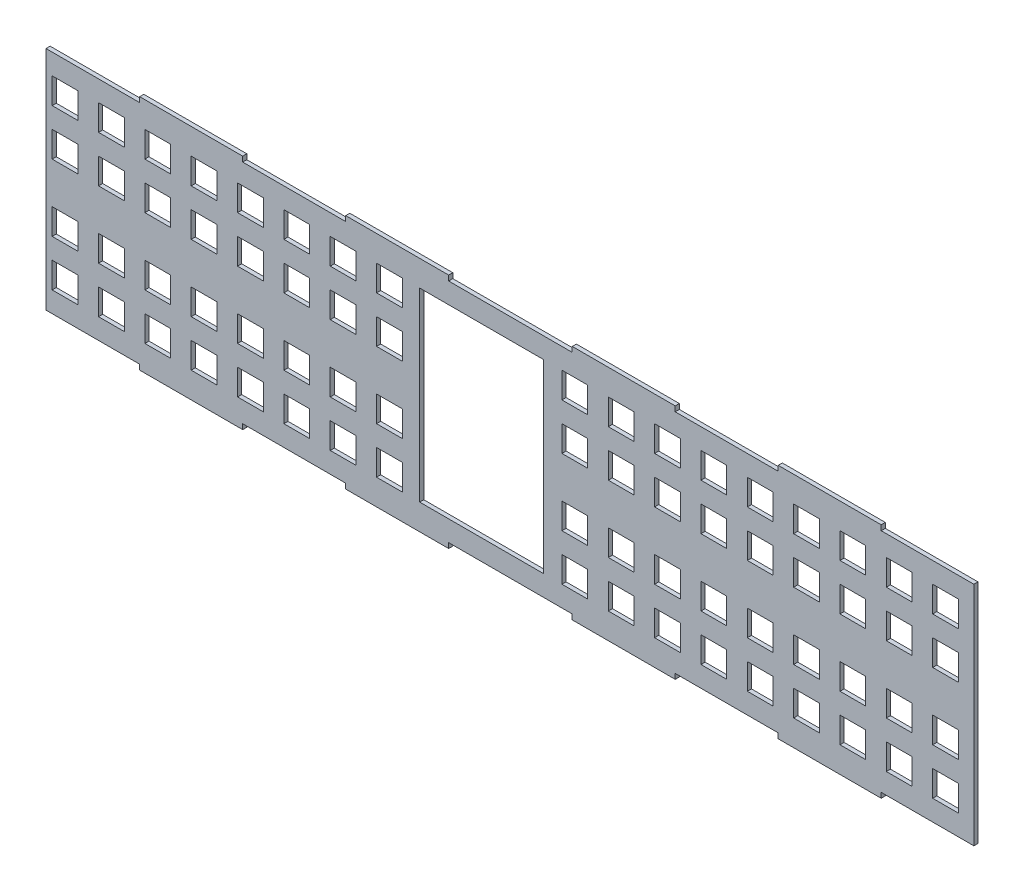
SolidWorks part; units mm, degrees
ref_plane "Front Plane" through (0, 0, 0) normal (0, 0, 1) x (1, 0, 0)
ref_plane "Top Plane" through (0, 0, 0) normal (0, 1, 0) x (1, 0, 0)
ref_plane "Right Plane" through (0, 0, 0) normal (1, 0, 0) x (0, 0, -1)
sketch "Croquis1" plane through (0, 0, 0) normal (0, 0, 1) x (1, 0, 0)
  line L0 (0, 0) -> (385.6404, 0) construction
  line L1 (-240, -55) -> (-180, -55)
  line L2 (-240, -55) -> (-240, 55)
  line L3 (-240, 55) -> (-180, 55)
  line L4 (240, -55) -> (240, 55)
  line L5 (-240, -55) -> (240, 55) construction
  line L6 (-240, 55) -> (240, -55) construction
  line L8 (-180, -55) -> (-180, -57.5)
  line L9 (-180, -57.5) -> (-130, -57.5)
  line L10 (-130, -55) -> (-130, -57.5)
  line L12 (-80, -55) -> (-80, -57.5)
  line L13 (-80, -57.5) -> (-30, -57.5)
  line L14 (-30, -55) -> (-30, -57.5)
  line L16 (30, -55) -> (30, -57.5)
  line L17 (30, -57.5) -> (80, -57.5)
  line L18 (80, -55) -> (80, -57.5)
  line L20 (130, -55) -> (130, -57.5)
  line L21 (130, -57.5) -> (180, -57.5)
  line L22 (180, -55) -> (180, -57.5)
  line L23 (180, 55) -> (180, 57.5)
  line L24 (130, 57.5) -> (180, 57.5)
  line L25 (130, 55) -> (130, 57.5)
  line L27 (80, 55) -> (80, 57.5)
  line L28 (30, 57.5) -> (80, 57.5)
  line L29 (30, 55) -> (30, 57.5)
  line L31 (-30, 55) -> (-30, 57.5)
  line L32 (-80, 57.5) -> (-30, 57.5)
  line L33 (-80, 55) -> (-80, 57.5)
  line L35 (-130, 55) -> (-130, 57.5)
  line L36 (-180, 57.5) -> (-130, 57.5)
  line L37 (-180, 55) -> (-180, 57.5)
  line L39 (-130, 55) -> (-80, 55)
  line L40 (-30, 55) -> (30, 55)
  line L41 (80, 55) -> (130, 55)
  line L42 (180, 55) -> (240, 55)
  line L43 (-130, -55) -> (-80, -55)
  line L44 (-30, -55) -> (30, -55)
  line L45 (80, -55) -> (130, -55)
  line L46 (180, -55) -> (240, -55)
  point P0 (0, 0)
  dimension "D1" = 480
  dimension "D2" = 110
  dimension "D3" = 60
  dimension "D4" = 50
  dimension "D5" = 50
  dimension "D6" = 50
  dimension "D7" = 50
  dimension "D8" = 60
  dimension "D9" = 50
  dimension "D10" = 50
  dimension "D11" = 60
  dimension "D12" = 2.5
  dimension "D13" = 2.5
  dimension "D14" = 2.5
extrude "Saliente-Extruir1" add sketch "Croquis1" along normal blind 2
sketch "Croquis2" plane through (0, 0, 2) normal (0, 0, 1) x (1, 0, 0)
  line L0 (-240, 0) -> (240, 0) construction
  line L1 (-240, 55) -> (-240, -55) construction
  line L2 (240, -55) -> (240, 55) construction
  line L29 (70, 45) -> (82.5, 32.5) construction
  line L34 (-210, 22.5) -> (-222.5, 10) construction
  line L35 (-210, 10) -> (-222.5, 22.5) construction
  line L36 (-210, 32.5) -> (-222.5, 45) construction
  line L37 (-210, 45) -> (-222.5, 32.5) construction
  line L46 (-222.5, 10) -> (-222.5, 22.5)
  line L47 (-210, 22.5) -> (-222.5, 22.5)
  line L48 (-210, 10) -> (-210, 22.5)
  line L49 (-210, 10) -> (-222.5, 10)
  line L50 (-222.5, 45) -> (-222.5, 32.5)
  line L51 (-210, 32.5) -> (-222.5, 32.5)
  line L52 (-210, 45) -> (-210, 32.5)
  line L53 (-210, 45) -> (-222.5, 45)
  line L54 (70, 32.5) -> (82.5, 45) construction
  line L55 (-200, 45) -> (-187.5, 32.5) construction
  line L56 (-200, 32.5) -> (-187.5, 45) construction
  line L57 (-200, 10) -> (-187.5, 22.5) construction
  line L58 (-200, 22.5) -> (-187.5, 10) construction
  line L59 (-165, 22.5) -> (-177.5, 10) construction
  line L60 (-165, 10) -> (-177.5, 22.5) construction
  line L61 (-165, 32.5) -> (-177.5, 45) construction
  line L62 (-165, 45) -> (-177.5, 32.5) construction
  line L63 (-155, 45) -> (-142.5, 32.5) construction
  line L64 (-155, 32.5) -> (-142.5, 45) construction
  line L65 (-155, 10) -> (-142.5, 22.5) construction
  line L66 (-155, 22.5) -> (-142.5, 10) construction
  line L67 (-120, 22.5) -> (-132.5, 10) construction
  line L68 (-120, 10) -> (-132.5, 22.5) construction
  line L69 (-120, 32.5) -> (-132.5, 45) construction
  line L70 (-120, 45) -> (-132.5, 32.5) construction
  line L71 (-200, 45) -> (-187.5, 45)
  line L72 (-200, 45) -> (-200, 32.5)
  line L73 (-200, 32.5) -> (-187.5, 32.5)
  line L74 (-187.5, 45) -> (-187.5, 32.5)
  line L75 (-200, 10) -> (-187.5, 10)
  line L76 (-200, 10) -> (-200, 22.5)
  line L77 (-200, 22.5) -> (-187.5, 22.5)
  line L78 (-187.5, 10) -> (-187.5, 22.5)
  line L79 (-177.5, 10) -> (-177.5, 22.5)
  line L80 (-165, 22.5) -> (-177.5, 22.5)
  line L81 (-165, 10) -> (-165, 22.5)
  line L82 (-165, 10) -> (-177.5, 10)
  line L83 (-177.5, 45) -> (-177.5, 32.5)
  line L84 (-165, 32.5) -> (-177.5, 32.5)
  line L85 (-165, 45) -> (-165, 32.5)
  line L86 (-165, 45) -> (-177.5, 45)
  line L87 (-155, 45) -> (-142.5, 45)
  line L88 (-155, 45) -> (-155, 32.5)
  line L89 (-155, 32.5) -> (-142.5, 32.5)
  line L90 (-142.5, 45) -> (-142.5, 32.5)
  line L91 (-155, 10) -> (-142.5, 10)
  line L92 (-155, 10) -> (-155, 22.5)
  line L93 (-155, 22.5) -> (-142.5, 22.5)
  line L94 (-142.5, 10) -> (-142.5, 22.5)
  line L95 (-132.5, 10) -> (-132.5, 22.5)
  line L96 (-120, 22.5) -> (-132.5, 22.5)
  line L97 (-120, 10) -> (-120, 22.5)
  line L98 (-120, 10) -> (-132.5, 10)
  line L99 (-132.5, 45) -> (-132.5, 32.5)
  line L100 (-120, 32.5) -> (-132.5, 32.5)
  line L101 (-120, 45) -> (-120, 32.5)
  line L102 (-120, 45) -> (-132.5, 45)
  line L103 (70, 10) -> (82.5, 22.5) construction
  line L104 (-110, 45) -> (-97.5, 32.5) construction
  line L105 (-110, 32.5) -> (-97.5, 45) construction
  line L106 (-110, 10) -> (-97.5, 22.5) construction
  line L107 (-110, 22.5) -> (-97.5, 10) construction
  line L108 (-75, 22.5) -> (-87.5, 10) construction
  line L109 (-75, 10) -> (-87.5, 22.5) construction
  line L110 (-75, 32.5) -> (-87.5, 45) construction
  line L111 (-75, 45) -> (-87.5, 32.5) construction
  line L112 (-65, 45) -> (-52.5, 32.5) construction
  line L113 (-65, 32.5) -> (-52.5, 45) construction
  line L114 (-65, 10) -> (-52.5, 22.5) construction
  line L115 (-65, 22.5) -> (-52.5, 10) construction
  line L116 (-30, 22.5) -> (-42.5, 10) construction
  line L117 (-30, 10) -> (-42.5, 22.5) construction
  line L118 (-30, 32.5) -> (-42.5, 45) construction
  line L119 (-30, 45) -> (-42.5, 32.5) construction
  line L120 (-20, 45) -> (-7.5, 32.5) construction
  line L121 (-20, 32.5) -> (-7.5, 45) construction
  line L122 (-20, 10) -> (-7.5, 22.5) construction
  line L123 (-20, 22.5) -> (-7.5, 10) construction
  line L124 (15, 22.5) -> (2.5, 10) construction
  line L125 (15, 10) -> (2.5, 22.5) construction
  line L126 (15, 32.5) -> (2.5, 45) construction
  line L127 (15, 45) -> (2.5, 32.5) construction
  line L128 (25, 45) -> (37.5, 32.5) construction
  line L129 (25, 32.5) -> (37.5, 45) construction
  line L130 (25, 10) -> (37.5, 22.5) construction
  line L131 (25, 22.5) -> (37.5, 10) construction
  line L132 (60, 22.5) -> (47.5, 10) construction
  line L133 (60, 10) -> (47.5, 22.5) construction
  line L134 (60, 32.5) -> (47.5, 45) construction
  line L135 (60, 45) -> (47.5, 32.5) construction
  line L136 (-110, 45) -> (-97.5, 45)
  line L137 (-110, 45) -> (-110, 32.5)
  line L138 (-110, 32.5) -> (-97.5, 32.5)
  line L139 (-97.5, 45) -> (-97.5, 32.5)
  line L140 (-110, 10) -> (-97.5, 10)
  line L141 (-110, 10) -> (-110, 22.5)
  line L142 (-110, 22.5) -> (-97.5, 22.5)
  line L143 (-97.5, 10) -> (-97.5, 22.5)
  line L144 (-87.5, 10) -> (-87.5, 22.5)
  line L145 (-75, 22.5) -> (-87.5, 22.5)
  line L146 (-75, 10) -> (-75, 22.5)
  line L147 (-75, 10) -> (-87.5, 10)
  line L148 (-87.5, 45) -> (-87.5, 32.5)
  line L149 (-75, 32.5) -> (-87.5, 32.5)
  line L150 (-75, 45) -> (-75, 32.5)
  line L151 (-75, 45) -> (-87.5, 45)
  line L152 (-65, 45) -> (-52.5, 45)
  line L153 (-65, 45) -> (-65, 32.5)
  line L154 (-65, 32.5) -> (-52.5, 32.5)
  line L155 (-52.5, 45) -> (-52.5, 32.5)
  line L156 (-65, 10) -> (-52.5, 10)
  line L157 (-65, 10) -> (-65, 22.5)
  line L158 (-65, 22.5) -> (-52.5, 22.5)
  line L159 (-52.5, 10) -> (-52.5, 22.5)
  line L160 (-42.5, 10) -> (-42.5, 22.5)
  line L161 (-30, 22.5) -> (-42.5, 22.5)
  line L162 (-30, 10) -> (-30, 22.5)
  line L163 (-30, 10) -> (-42.5, 10)
  line L164 (-42.5, 45) -> (-42.5, 32.5)
  line L165 (-30, 32.5) -> (-42.5, 32.5)
  line L166 (-30, 45) -> (-30, 32.5)
  line L167 (-30, 45) -> (-42.5, 45)
  line L168 (-20, 45) -> (-7.5, 45)
  line L169 (-20, 45) -> (-20, 32.5)
  line L170 (-20, 32.5) -> (-7.5, 32.5)
  line L171 (-7.5, 45) -> (-7.5, 32.5)
  line L172 (-20, 10) -> (-7.5, 10)
  line L173 (-20, 10) -> (-20, 22.5)
  line L174 (-20, 22.5) -> (-7.5, 22.5)
  line L175 (-7.5, 10) -> (-7.5, 22.5)
  line L176 (2.5, 10) -> (2.5, 22.5)
  line L177 (15, 22.5) -> (2.5, 22.5)
  line L178 (15, 10) -> (15, 22.5)
  line L179 (15, 10) -> (2.5, 10)
  line L180 (2.5, 45) -> (2.5, 32.5)
  line L181 (15, 32.5) -> (2.5, 32.5)
  line L182 (15, 45) -> (15, 32.5)
  line L183 (15, 45) -> (2.5, 45)
  line L184 (25, 45) -> (37.5, 45)
  line L185 (25, 45) -> (25, 32.5)
  line L186 (25, 32.5) -> (37.5, 32.5)
  line L187 (37.5, 45) -> (37.5, 32.5)
  line L188 (25, 10) -> (37.5, 10)
  line L189 (25, 10) -> (25, 22.5)
  line L190 (25, 22.5) -> (37.5, 22.5)
  line L191 (37.5, 10) -> (37.5, 22.5)
  line L192 (47.5, 10) -> (47.5, 22.5)
  line L193 (60, 22.5) -> (47.5, 22.5)
  line L194 (60, 10) -> (60, 22.5)
  line L195 (60, 10) -> (47.5, 10)
  line L196 (47.5, 45) -> (47.5, 32.5)
  line L197 (60, 32.5) -> (47.5, 32.5)
  line L198 (60, 45) -> (60, 32.5)
  line L199 (60, 45) -> (47.5, 45)
  line L200 (70, 22.5) -> (82.5, 10) construction
  line L201 (105, 22.5) -> (92.5, 10) construction
  line L202 (105, 10) -> (92.5, 22.5) construction
  line L203 (105, 32.5) -> (92.5, 45) construction
  line L204 (105, 45) -> (92.5, 32.5) construction
  line L205 (115, 45) -> (127.5, 32.5) construction
  line L206 (115, 32.5) -> (127.5, 45) construction
  line L207 (115, 10) -> (127.5, 22.5) construction
  line L208 (115, 22.5) -> (127.5, 10) construction
  line L209 (150, 22.5) -> (137.5, 10) construction
  line L210 (150, 10) -> (137.5, 22.5) construction
  line L211 (150, 32.5) -> (137.5, 45) construction
  line L212 (150, 45) -> (137.5, 32.5) construction
  line L213 (160, 45) -> (172.5, 32.5) construction
  line L214 (160, 32.5) -> (172.5, 45) construction
  line L215 (160, 10) -> (172.5, 22.5) construction
  line L216 (160, 22.5) -> (172.5, 10) construction
  line L217 (195, 22.5) -> (182.5, 10) construction
  line L218 (195, 10) -> (182.5, 22.5) construction
  line L219 (195, 32.5) -> (182.5, 45) construction
  line L220 (195, 45) -> (182.5, 32.5) construction
  line L221 (205, 45) -> (217.5, 32.5) construction
  line L222 (205, 32.5) -> (217.5, 45) construction
  line L223 (205, 10) -> (217.5, 22.5) construction
  line L224 (205, 22.5) -> (217.5, 10) construction
  line L248 (205, -22.5) -> (217.5, -10) construction
  line L249 (205, -10) -> (217.5, -22.5) construction
  line L250 (205, -32.5) -> (217.5, -45) construction
  line L251 (205, -45) -> (217.5, -32.5) construction
  line L252 (195, -45) -> (182.5, -32.5) construction
  line L253 (195, -32.5) -> (182.5, -45) construction
  line L254 (195, -10) -> (182.5, -22.5) construction
  line L255 (195, -22.5) -> (182.5, -10) construction
  line L256 (160, -22.5) -> (172.5, -10) construction
  line L257 (160, -10) -> (172.5, -22.5) construction
  line L258 (160, -32.5) -> (172.5, -45) construction
  line L259 (160, -45) -> (172.5, -32.5) construction
  line L260 (150, -45) -> (137.5, -32.5) construction
  line L261 (70, 45) -> (82.5, 45)
  line L262 (70, 45) -> (70, 32.5)
  line L263 (70, 32.5) -> (82.5, 32.5)
  line L264 (82.5, 45) -> (82.5, 32.5)
  line L265 (70, 10) -> (82.5, 10)
  line L266 (70, 10) -> (70, 22.5)
  line L267 (70, 22.5) -> (82.5, 22.5)
  line L268 (82.5, 10) -> (82.5, 22.5)
  line L269 (92.5, 10) -> (92.5, 22.5)
  line L270 (105, 22.5) -> (92.5, 22.5)
  line L271 (105, 10) -> (105, 22.5)
  line L272 (105, 10) -> (92.5, 10)
  line L273 (92.5, 45) -> (92.5, 32.5)
  line L274 (105, 32.5) -> (92.5, 32.5)
  line L275 (105, 45) -> (105, 32.5)
  line L276 (105, 45) -> (92.5, 45)
  line L277 (115, 45) -> (127.5, 45)
  line L278 (115, 45) -> (115, 32.5)
  line L279 (115, 32.5) -> (127.5, 32.5)
  line L280 (127.5, 45) -> (127.5, 32.5)
  line L281 (115, 10) -> (127.5, 10)
  line L282 (115, 10) -> (115, 22.5)
  line L283 (115, 22.5) -> (127.5, 22.5)
  line L284 (127.5, 10) -> (127.5, 22.5)
  line L285 (137.5, 10) -> (137.5, 22.5)
  line L286 (150, 22.5) -> (137.5, 22.5)
  line L287 (150, 10) -> (150, 22.5)
  line L288 (150, 10) -> (137.5, 10)
  line L289 (137.5, 45) -> (137.5, 32.5)
  line L290 (150, 32.5) -> (137.5, 32.5)
  line L291 (150, 45) -> (150, 32.5)
  line L292 (150, 45) -> (137.5, 45)
  line L293 (160, 45) -> (172.5, 45)
  line L294 (160, 45) -> (160, 32.5)
  line L295 (160, 32.5) -> (172.5, 32.5)
  line L296 (172.5, 45) -> (172.5, 32.5)
  line L297 (160, 10) -> (172.5, 10)
  line L298 (160, 10) -> (160, 22.5)
  line L299 (160, 22.5) -> (172.5, 22.5)
  line L300 (172.5, 10) -> (172.5, 22.5)
  line L301 (182.5, 10) -> (182.5, 22.5)
  line L302 (195, 22.5) -> (182.5, 22.5)
  line L303 (195, 10) -> (195, 22.5)
  line L304 (195, 10) -> (182.5, 10)
  line L305 (182.5, 45) -> (182.5, 32.5)
  line L306 (195, 32.5) -> (182.5, 32.5)
  line L307 (195, 45) -> (195, 32.5)
  line L308 (195, 45) -> (182.5, 45)
  line L309 (205, 45) -> (217.5, 45)
  line L310 (205, 45) -> (205, 32.5)
  line L311 (205, 32.5) -> (217.5, 32.5)
  line L312 (217.5, 45) -> (217.5, 32.5)
  line L313 (205, 10) -> (217.5, 10)
  line L314 (205, 10) -> (205, 22.5)
  line L315 (205, 22.5) -> (217.5, 22.5)
  line L316 (217.5, 10) -> (217.5, 22.5)
  line L389 (150, -32.5) -> (137.5, -45) construction
  line L390 (150, -10) -> (137.5, -22.5) construction
  line L391 (150, -22.5) -> (137.5, -10) construction
  line L392 (115, -22.5) -> (127.5, -10) construction
  line L393 (115, -10) -> (127.5, -22.5) construction
  line L394 (115, -32.5) -> (127.5, -45) construction
  line L395 (115, -45) -> (127.5, -32.5) construction
  line L396 (105, -45) -> (92.5, -32.5) construction
  line L397 (105, -32.5) -> (92.5, -45) construction
  line L398 (105, -10) -> (92.5, -22.5) construction
  line L399 (105, -22.5) -> (92.5, -10) construction
  line L400 (70, -22.5) -> (82.5, -10) construction
  line L401 (60, -45) -> (47.5, -32.5) construction
  line L402 (60, -32.5) -> (47.5, -45) construction
  line L403 (60, -10) -> (47.5, -22.5) construction
  line L404 (60, -22.5) -> (47.5, -10) construction
  line L405 (25, -22.5) -> (37.5, -10) construction
  line L406 (25, -10) -> (37.5, -22.5) construction
  line L407 (25, -32.5) -> (37.5, -45) construction
  line L408 (25, -45) -> (37.5, -32.5) construction
  line L409 (15, -45) -> (2.5, -32.5) construction
  line L410 (15, -32.5) -> (2.5, -45) construction
  line L411 (15, -10) -> (2.5, -22.5) construction
  line L412 (15, -22.5) -> (2.5, -10) construction
  line L413 (-20, -22.5) -> (-7.5, -10) construction
  line L414 (-20, -10) -> (-7.5, -22.5) construction
  line L415 (-20, -32.5) -> (-7.5, -45) construction
  line L416 (-20, -45) -> (-7.5, -32.5) construction
  line L417 (-30, -45) -> (-42.5, -32.5) construction
  line L418 (-30, -32.5) -> (-42.5, -45) construction
  line L419 (-30, -10) -> (-42.5, -22.5) construction
  line L420 (-30, -22.5) -> (-42.5, -10) construction
  line L421 (-65, -22.5) -> (-52.5, -10) construction
  line L422 (-65, -10) -> (-52.5, -22.5) construction
  line L423 (-65, -32.5) -> (-52.5, -45) construction
  line L424 (-65, -45) -> (-52.5, -32.5) construction
  line L425 (-75, -45) -> (-87.5, -32.5) construction
  line L426 (-75, -32.5) -> (-87.5, -45) construction
  line L427 (-75, -10) -> (-87.5, -22.5) construction
  line L428 (-75, -22.5) -> (-87.5, -10) construction
  line L429 (-110, -22.5) -> (-97.5, -10) construction
  line L430 (-110, -10) -> (-97.5, -22.5) construction
  line L431 (-110, -32.5) -> (-97.5, -45) construction
  line L432 (-110, -45) -> (-97.5, -32.5) construction
  line L433 (70, -10) -> (82.5, -22.5) construction
  line L434 (-120, -45) -> (-132.5, -32.5) construction
  line L435 (-120, -32.5) -> (-132.5, -45) construction
  line L436 (-120, -10) -> (-132.5, -22.5) construction
  line L437 (-120, -22.5) -> (-132.5, -10) construction
  line L438 (-155, -22.5) -> (-142.5, -10) construction
  line L439 (-155, -10) -> (-142.5, -22.5) construction
  line L440 (-155, -32.5) -> (-142.5, -45) construction
  line L441 (-155, -45) -> (-142.5, -32.5) construction
  line L442 (-165, -45) -> (-177.5, -32.5) construction
  line L443 (-165, -32.5) -> (-177.5, -45) construction
  line L444 (-165, -10) -> (-177.5, -22.5) construction
  line L445 (-165, -22.5) -> (-177.5, -10) construction
  line L446 (-200, -22.5) -> (-187.5, -10) construction
  line L447 (-200, -10) -> (-187.5, -22.5) construction
  line L448 (-200, -32.5) -> (-187.5, -45) construction
  line L449 (-200, -45) -> (-187.5, -32.5) construction
  line L450 (70, -32.5) -> (82.5, -45) construction
  line L451 (-210, -45) -> (-222.5, -32.5) construction
  line L452 (-210, -32.5) -> (-222.5, -45) construction
  line L453 (-210, -10) -> (-222.5, -22.5) construction
  line L454 (-210, -22.5) -> (-222.5, -10) construction
  line L459 (70, -45) -> (82.5, -32.5) construction
  line L492 (217.5, -10) -> (217.5, -22.5)
  line L493 (205, -22.5) -> (217.5, -22.5)
  line L494 (205, -10) -> (205, -22.5)
  line L495 (205, -10) -> (217.5, -10)
  line L496 (217.5, -45) -> (217.5, -32.5)
  line L497 (205, -32.5) -> (217.5, -32.5)
  line L498 (205, -45) -> (205, -32.5)
  line L499 (205, -45) -> (217.5, -45)
  line L500 (195, -45) -> (182.5, -45)
  line L501 (195, -45) -> (195, -32.5)
  line L502 (195, -32.5) -> (182.5, -32.5)
  line L503 (182.5, -45) -> (182.5, -32.5)
  line L504 (195, -10) -> (182.5, -10)
  line L505 (195, -10) -> (195, -22.5)
  line L506 (195, -22.5) -> (182.5, -22.5)
  line L507 (182.5, -10) -> (182.5, -22.5)
  line L508 (172.5, -10) -> (172.5, -22.5)
  line L509 (160, -22.5) -> (172.5, -22.5)
  line L510 (160, -10) -> (160, -22.5)
  line L511 (160, -10) -> (172.5, -10)
  line L512 (172.5, -45) -> (172.5, -32.5)
  line L513 (160, -32.5) -> (172.5, -32.5)
  line L514 (160, -45) -> (160, -32.5)
  line L515 (160, -45) -> (172.5, -45)
  line L516 (150, -45) -> (137.5, -45)
  line L517 (150, -45) -> (150, -32.5)
  line L518 (150, -32.5) -> (137.5, -32.5)
  line L519 (137.5, -45) -> (137.5, -32.5)
  line L520 (150, -10) -> (137.5, -10)
  line L521 (150, -10) -> (150, -22.5)
  line L522 (150, -22.5) -> (137.5, -22.5)
  line L523 (137.5, -10) -> (137.5, -22.5)
  line L524 (127.5, -10) -> (127.5, -22.5)
  line L525 (115, -22.5) -> (127.5, -22.5)
  line L526 (115, -10) -> (115, -22.5)
  line L527 (115, -10) -> (127.5, -10)
  line L528 (127.5, -45) -> (127.5, -32.5)
  line L529 (115, -32.5) -> (127.5, -32.5)
  line L530 (115, -45) -> (115, -32.5)
  line L531 (115, -45) -> (127.5, -45)
  line L532 (105, -45) -> (92.5, -45)
  line L533 (105, -45) -> (105, -32.5)
  line L534 (105, -32.5) -> (92.5, -32.5)
  line L535 (92.5, -45) -> (92.5, -32.5)
  line L536 (105, -10) -> (92.5, -10)
  line L537 (105, -10) -> (105, -22.5)
  line L538 (105, -22.5) -> (92.5, -22.5)
  line L539 (92.5, -10) -> (92.5, -22.5)
  line L540 (82.5, -10) -> (82.5, -22.5)
  line L541 (70, -22.5) -> (82.5, -22.5)
  line L542 (70, -10) -> (70, -22.5)
  line L543 (70, -10) -> (82.5, -10)
  line L544 (82.5, -45) -> (82.5, -32.5)
  line L545 (70, -32.5) -> (82.5, -32.5)
  line L546 (70, -45) -> (70, -32.5)
  line L547 (70, -45) -> (82.5, -45)
  line L548 (60, -45) -> (47.5, -45)
  line L549 (60, -45) -> (60, -32.5)
  line L550 (60, -32.5) -> (47.5, -32.5)
  line L551 (47.5, -45) -> (47.5, -32.5)
  line L552 (60, -10) -> (47.5, -10)
  line L553 (60, -10) -> (60, -22.5)
  line L554 (60, -22.5) -> (47.5, -22.5)
  line L555 (47.5, -10) -> (47.5, -22.5)
  line L556 (37.5, -10) -> (37.5, -22.5)
  line L557 (25, -22.5) -> (37.5, -22.5)
  line L558 (25, -10) -> (25, -22.5)
  line L559 (25, -10) -> (37.5, -10)
  line L560 (37.5, -45) -> (37.5, -32.5)
  line L561 (25, -32.5) -> (37.5, -32.5)
  line L562 (25, -45) -> (25, -32.5)
  line L563 (25, -45) -> (37.5, -45)
  line L564 (15, -45) -> (2.5, -45)
  line L565 (15, -45) -> (15, -32.5)
  line L566 (15, -32.5) -> (2.5, -32.5)
  line L567 (2.5, -45) -> (2.5, -32.5)
  line L568 (15, -10) -> (2.5, -10)
  line L569 (15, -10) -> (15, -22.5)
  line L570 (15, -22.5) -> (2.5, -22.5)
  line L571 (2.5, -10) -> (2.5, -22.5)
  line L572 (-7.5, -10) -> (-7.5, -22.5)
  line L573 (-20, -22.5) -> (-7.5, -22.5)
  line L574 (-20, -10) -> (-20, -22.5)
  line L575 (-20, -10) -> (-7.5, -10)
  line L576 (-7.5, -45) -> (-7.5, -32.5)
  line L577 (-20, -32.5) -> (-7.5, -32.5)
  line L578 (-20, -45) -> (-20, -32.5)
  line L579 (-20, -45) -> (-7.5, -45)
  line L580 (-30, -45) -> (-42.5, -45)
  line L581 (-30, -45) -> (-30, -32.5)
  line L582 (-30, -32.5) -> (-42.5, -32.5)
  line L583 (-42.5, -45) -> (-42.5, -32.5)
  line L584 (-30, -10) -> (-42.5, -10)
  line L585 (-30, -10) -> (-30, -22.5)
  line L586 (-30, -22.5) -> (-42.5, -22.5)
  line L587 (-42.5, -10) -> (-42.5, -22.5)
  line L588 (-52.5, -10) -> (-52.5, -22.5)
  line L589 (-65, -22.5) -> (-52.5, -22.5)
  line L590 (-65, -10) -> (-65, -22.5)
  line L591 (-65, -10) -> (-52.5, -10)
  line L592 (-52.5, -45) -> (-52.5, -32.5)
  line L593 (-65, -32.5) -> (-52.5, -32.5)
  line L594 (-65, -45) -> (-65, -32.5)
  line L595 (-65, -45) -> (-52.5, -45)
  line L596 (-75, -45) -> (-87.5, -45)
  line L597 (-75, -45) -> (-75, -32.5)
  line L598 (-75, -32.5) -> (-87.5, -32.5)
  line L599 (-87.5, -45) -> (-87.5, -32.5)
  line L600 (-75, -10) -> (-87.5, -10)
  line L601 (-75, -10) -> (-75, -22.5)
  line L602 (-75, -22.5) -> (-87.5, -22.5)
  line L603 (-87.5, -10) -> (-87.5, -22.5)
  line L604 (-97.5, -10) -> (-97.5, -22.5)
  line L605 (-110, -22.5) -> (-97.5, -22.5)
  line L606 (-110, -10) -> (-110, -22.5)
  line L607 (-110, -10) -> (-97.5, -10)
  line L608 (-97.5, -45) -> (-97.5, -32.5)
  line L609 (-110, -32.5) -> (-97.5, -32.5)
  line L610 (-110, -45) -> (-110, -32.5)
  line L611 (-110, -45) -> (-97.5, -45)
  line L612 (-120, -45) -> (-132.5, -45)
  line L613 (-120, -45) -> (-120, -32.5)
  line L614 (-120, -32.5) -> (-132.5, -32.5)
  line L615 (-132.5, -45) -> (-132.5, -32.5)
  line L616 (-120, -10) -> (-132.5, -10)
  line L617 (-120, -10) -> (-120, -22.5)
  line L618 (-120, -22.5) -> (-132.5, -22.5)
  line L619 (-132.5, -10) -> (-132.5, -22.5)
  line L620 (-142.5, -10) -> (-142.5, -22.5)
  line L621 (-155, -22.5) -> (-142.5, -22.5)
  line L622 (-155, -10) -> (-155, -22.5)
  line L623 (-155, -10) -> (-142.5, -10)
  line L624 (-142.5, -45) -> (-142.5, -32.5)
  line L625 (-155, -32.5) -> (-142.5, -32.5)
  line L626 (-155, -45) -> (-155, -32.5)
  line L627 (-155, -45) -> (-142.5, -45)
  line L628 (-165, -45) -> (-177.5, -45)
  line L629 (-165, -45) -> (-165, -32.5)
  line L630 (-165, -32.5) -> (-177.5, -32.5)
  line L631 (-177.5, -45) -> (-177.5, -32.5)
  line L632 (-165, -10) -> (-177.5, -10)
  line L633 (-165, -10) -> (-165, -22.5)
  line L634 (-165, -22.5) -> (-177.5, -22.5)
  line L635 (-177.5, -10) -> (-177.5, -22.5)
  line L636 (-187.5, -10) -> (-187.5, -22.5)
  line L637 (-200, -22.5) -> (-187.5, -22.5)
  line L638 (-200, -10) -> (-200, -22.5)
  line L639 (-200, -10) -> (-187.5, -10)
  line L640 (-187.5, -45) -> (-187.5, -32.5)
  line L641 (-200, -32.5) -> (-187.5, -32.5)
  line L642 (-200, -45) -> (-200, -32.5)
  line L643 (-200, -45) -> (-187.5, -45)
  line L644 (-210, -45) -> (-222.5, -45)
  line L645 (-210, -45) -> (-210, -32.5)
  line L646 (-210, -32.5) -> (-222.5, -32.5)
  line L647 (-222.5, -45) -> (-222.5, -32.5)
  line L648 (-210, -10) -> (-222.5, -10)
  line L649 (-210, -10) -> (-210, -22.5)
  line L650 (-210, -22.5) -> (-222.5, -22.5)
  line L651 (-222.5, -10) -> (-222.5, -22.5)
  point P50 (-216.25, 16.25)
  point P51 (-216.25, 38.75)
  point P86 (-193.75, 38.75)
  point P87 (-193.75, 16.25)
  point P88 (-171.25, 16.25)
  point P89 (-171.25, 38.75)
  point P90 (-148.75, 38.75)
  point P91 (-148.75, 16.25)
  point P92 (-126.25, 16.25)
  point P93 (-126.25, 38.75)
  point P160 (-103.75, 38.75)
  point P161 (-103.75, 16.25)
  point P162 (-81.25, 16.25)
  point P163 (-81.25, 38.75)
  point P164 (-58.75, 38.75)
  point P165 (-58.75, 16.25)
  point P166 (-36.25, 16.25)
  point P167 (-36.25, 38.75)
  point P168 (-13.75, 38.75)
  point P169 (-13.75, 16.25)
  point P170 (8.75, 16.25)
  point P171 (8.75, 38.75)
  point P172 (31.25, 38.75)
  point P173 (31.25, 16.25)
  point P174 (53.75, 16.25)
  point P175 (53.75, 38.75)
  point P298 (76.25, 38.75)
  point P299 (76.25, 16.25)
  point P300 (98.75, 16.25)
  point P301 (98.75, 38.75)
  point P302 (121.25, 38.75)
  point P303 (121.25, 16.25)
  point P304 (143.75, 16.25)
  point P305 (143.75, 38.75)
  point P306 (166.25, 38.75)
  point P307 (166.25, 16.25)
  point P308 (188.75, 16.25)
  point P309 (188.75, 38.75)
  point P310 (211.25, 38.75)
  point P311 (211.25, 16.25)
  point P482 (211.25, -16.25)
  point P483 (211.25, -38.75)
  point P484 (188.75, -38.75)
  point P485 (188.75, -16.25)
  point P486 (166.25, -16.25)
  point P487 (166.25, -38.75)
  point P488 (143.75, -38.75)
  point P489 (143.75, -16.25)
  point P490 (121.25, -16.25)
  point P491 (121.25, -38.75)
  point P492 (98.75, -38.75)
  point P493 (98.75, -16.25)
  point P494 (76.25, -16.25)
  point P495 (76.25, -38.75)
  point P496 (53.75, -38.75)
  point P497 (53.75, -16.25)
  point P498 (31.25, -16.25)
  point P499 (31.25, -38.75)
  point P500 (8.75, -38.75)
  point P501 (8.75, -16.25)
  point P502 (-13.75, -16.25)
  point P503 (-13.75, -38.75)
  point P504 (-36.25, -38.75)
  point P505 (-36.25, -16.25)
  point P506 (-58.75, -16.25)
  point P507 (-58.75, -38.75)
  point P508 (-81.25, -38.75)
  point P509 (-81.25, -16.25)
  point P510 (-103.75, -16.25)
  point P511 (-103.75, -38.75)
  point P512 (-126.25, -38.75)
  point P513 (-126.25, -16.25)
  point P514 (-148.75, -16.25)
  point P515 (-148.75, -38.75)
  point P516 (-171.25, -38.75)
  point P517 (-171.25, -16.25)
  point P518 (-193.75, -16.25)
  point P519 (-193.75, -38.75)
  point P520 (-216.25, -38.75)
  point P521 (-216.25, -16.25)
extrude "Cortar-Extruir1" cut sketch "Croquis2" against normal blind 5
sketch "Croquis5" plane through (0, 0, 0) normal (0, 0, -1) x (-1, 0, 0)
  line L0 (240, -55) -> (180, -55) construction
  line L1 (240, 55) -> (228, 55)
  line L2 (240, 55) -> (240, -55)
  line L3 (240, -55) -> (228, -55)
  line L4 (228, 55) -> (228, -55)
  dimension "D1" = 12
extrude "Cortar-Extruir3" cut sketch "Croquis5" against normal blind 3
sketch "Croquis6" plane through (0, 0, 0) normal (0, 0, -1) x (-1, 0, 0)
  line L0 (-180, -55) -> (-240, -55) construction
  line L1 (-240, 55) -> (-225, 55)
  line L2 (-240, 55) -> (-240, -55)
  line L3 (-240, -55) -> (-225, -55)
  line L4 (-225, 55) -> (-225, -55)
  dimension "D1" = 15
extrude "Cortar-Extruir4" cut sketch "Croquis6" against normal blind 3
sketch "Croquis7" plane through (0, 0, 2) normal (0, 0, 1) x (1, 0, 0)
  line L0 (-228, -55) -> (-180, -55) construction
  line L1 (-228, 55) -> (-225.5, 55)
  line L2 (-228, 55) -> (-228, -55)
  line L3 (-228, -55) -> (-225.5, -55)
  line L4 (-225.5, 55) -> (-225.5, -55)
  dimension "D1" = 2.5
extrude "Cortar-Extruir5" cut sketch "Croquis7" against normal blind 3
sketch "Sketch1" plane through (0, 0, 2) normal (0, 0, 1) x (1, 0, 0)
  line L0 (-7.5, 45) -> (-20, 45) construction
  line L1 (-44.0663, -45) -> (15.9337, -45)
  line L2 (-44.0663, -45) -> (-44.0663, 45)
  line L3 (-44.0663, 45) -> (15.9337, 45)
  line L4 (15.9337, -45) -> (15.9337, 45)
  point P0 (-14.4205, 0)
  dimension "D1" = 0
  dimension "D2" = 60
extrude "Cut-Extrude1" cut sketch "Sketch1" against normal blind 3
